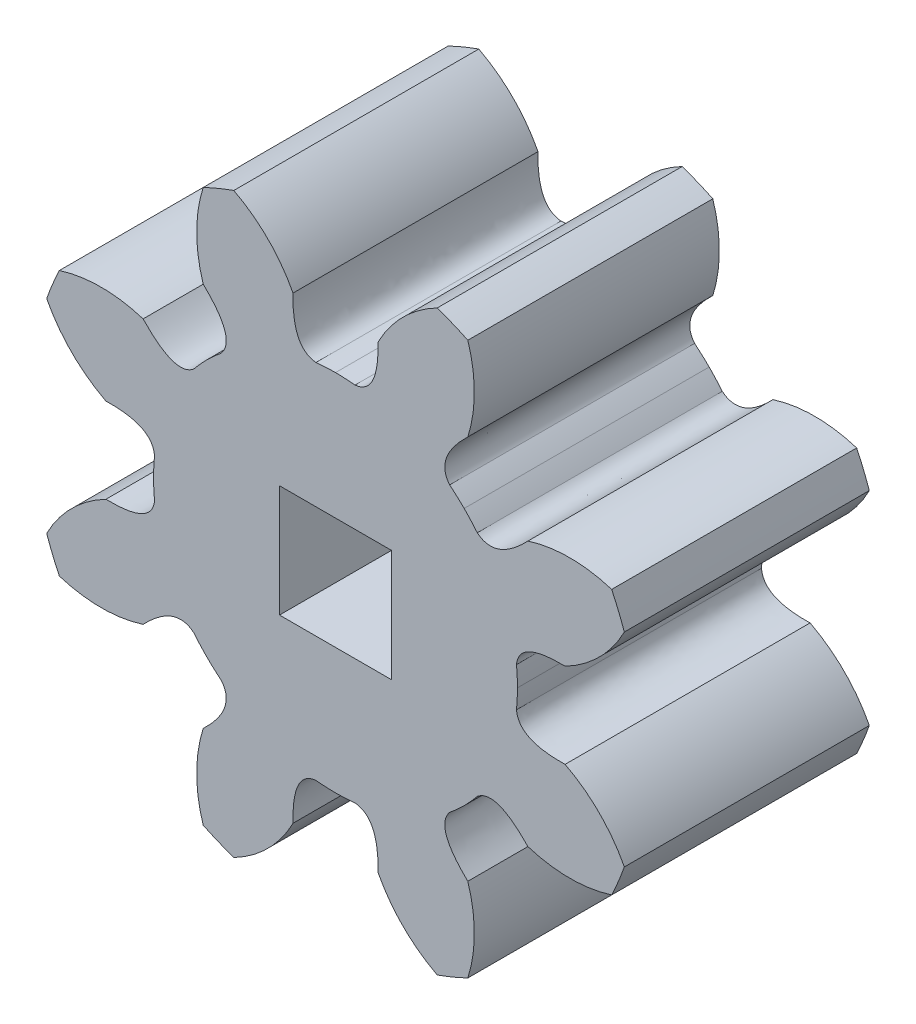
SolidWorks part; units mm, degrees
ref_plane "Front Plane" through (0, 0, 0) normal (0, 0, 1) x (1, 0, 0)
ref_plane "Top Plane" through (0, 0, 0) normal (0, 1, 0) x (1, 0, 0)
ref_plane "Right Plane" through (0, 0, 0) normal (1, 0, 0) x (0, 0, -1)
sketch "Sketch1" plane through (0, 0, 0) normal (0, 0, 1) x (1, 0, 0)
  line L0 (3.1669, -7.6908) -> (3.1183, -7.4689)
  line L1 (3.1183, -7.4689) -> (3.0812, -7.2576)
  line L2 (3.0812, -7.2576) -> (3.0547, -7.0583)
  line L3 (3.0547, -7.0583) -> (3.0374, -6.8671)
  line L4 (3.0374, -6.8671) -> (3.0287, -6.6862)
  line L5 (3.0287, -6.6862) -> (3.0277, -6.5196)
  line L6 (3.0277, -6.5196) -> (3.0333, -6.3633)
  line L7 (3.0333, -6.3633) -> (3.0445, -6.2188)
  line L8 (3.0445, -6.2188) -> (3.0799, -5.966)
  line L9 (3.0799, -5.966) -> (3.1262, -5.7615)
  line L10 (3.1262, -5.7615) -> (3.1751, -5.6067)
  line L11 (3.1751, -5.6067) -> (3.2199, -5.4976)
  line L12 (3.2199, -5.4976) -> (3.3298, -5.3972)
  line L13 (3.3298, -5.3972) -> (3.4539, -5.2724)
  line L14 (3.4539, -5.2724) -> (3.5614, -5.1472)
  line L15 (3.5614, -5.1472) -> (3.6523, -5.0227)
  line L16 (3.6523, -5.0227) -> (3.727, -4.9001)
  line L17 (3.727, -4.9001) -> (3.7859, -4.7804)
  line L18 (3.7859, -4.7804) -> (3.8292, -4.6649)
  line L19 (3.8292, -4.6649) -> (3.8574, -4.5546)
  line L20 (3.8574, -4.5546) -> (3.8712, -4.4505)
  line L21 (3.8712, -4.4505) -> (3.8711, -4.3537)
  line L22 (3.8711, -4.3537) -> (3.8576, -4.2651)
  line L23 (3.8576, -4.2651) -> (3.8317, -4.1856)
  line L24 (3.8317, -4.1856) -> (3.7939, -4.1161)
  line L25 (3.7939, -4.1161) -> (3.7383, -4.051)
  line L26 (3.7383, -4.051) -> (3.5929, -3.9283)
  line L27 (3.5929, -3.9283) -> (3.4307, -3.7816)
  line L28 (3.4307, -3.7816) -> (3.323, -3.677)
  line L29 (3.323, -3.677) -> (3.2184, -3.5693)
  line L30 (3.2184, -3.5693) -> (3.0717, -3.4071)
  line L31 (3.0717, -3.4071) -> (2.949, -3.2617)
  line L32 (2.949, -3.2617) -> (2.8839, -3.2061)
  line L33 (2.8839, -3.2061) -> (2.8144, -3.1683)
  line L34 (2.8144, -3.1683) -> (2.7349, -3.1424)
  line L35 (2.7349, -3.1424) -> (2.6463, -3.1289)
  line L36 (2.6463, -3.1289) -> (2.5495, -3.1288)
  line L37 (2.5495, -3.1288) -> (2.4454, -3.1426)
  line L38 (2.4454, -3.1426) -> (2.3351, -3.1708)
  line L39 (2.3351, -3.1708) -> (2.2196, -3.2141)
  line L40 (2.2196, -3.2141) -> (2.0999, -3.273)
  line L41 (2.0999, -3.273) -> (1.9773, -3.3477)
  line L42 (1.9773, -3.3477) -> (1.8528, -3.4386)
  line L43 (1.8528, -3.4386) -> (1.7276, -3.5461)
  line L44 (1.7276, -3.5461) -> (1.6028, -3.6702)
  line L45 (1.6028, -3.6702) -> (1.5024, -3.7801)
  line L46 (1.5024, -3.7801) -> (1.3933, -3.8249)
  line L47 (1.3933, -3.8249) -> (1.2385, -3.8738)
  line L48 (1.2385, -3.8738) -> (1.034, -3.9201)
  line L49 (1.034, -3.9201) -> (0.7812, -3.9555)
  line L50 (0.7812, -3.9555) -> (0.6367, -3.9667)
  line L51 (0.6367, -3.9667) -> (0.4804, -3.9723)
  line L52 (0.4804, -3.9723) -> (0.3138, -3.9713)
  line L53 (0.3138, -3.9713) -> (0.1329, -3.9626)
  line L54 (0.1329, -3.9626) -> (-0.0583, -3.9453)
  line L55 (-0.0583, -3.9453) -> (-0.2576, -3.9188)
  line L56 (-0.2576, -3.9188) -> (-0.4689, -3.8817)
  line L57 (-0.4689, -3.8817) -> (-0.6908, -3.8331)
  line L58 (-0.6908, -3.8331) -> (-0.891, -3.7806)
  line L59 (-1.2531, -2.9065) -> (-1.1486, -2.7278)
  line L60 (-1.1486, -2.7278) -> (-1.0261, -2.5365)
  line L61 (-1.0261, -2.5365) -> (-0.9029, -2.3609)
  line L62 (-0.9029, -2.3609) -> (-0.7807, -2.2012)
  line L63 (-0.7807, -2.2012) -> (-0.6577, -2.0538)
  line L64 (-0.6577, -2.0538) -> (-0.536, -1.9197)
  line L65 (-0.536, -1.9197) -> (-0.4189, -1.8013)
  line L66 (-0.4189, -1.8013) -> (-0.3044, -1.6946)
  line L67 (-0.3044, -1.6946) -> (-0.1943, -1.6004)
  line L68 (-0.1943, -1.6004) -> (0.0094, -1.4467)
  line L69 (0.0094, -1.4467) -> (0.1868, -1.3348)
  line L70 (0.1868, -1.3348) -> (0.3308, -1.2599)
  line L71 (0.3308, -1.2599) -> (0.4397, -1.2144)
  line L72 (0.4397, -1.2144) -> (0.5884, -1.2212)
  line L73 (0.5884, -1.2212) -> (0.7644, -1.2207)
  line L74 (0.7644, -1.2207) -> (0.9289, -1.2082)
  line L75 (0.9289, -1.2082) -> (1.0813, -1.1844)
  line L76 (1.0813, -1.1844) -> (1.2208, -1.1505)
  line L77 (1.2208, -1.1505) -> (1.347, -1.1075)
  line L78 (1.347, -1.1075) -> (1.4593, -1.0565)
  line L79 (1.4593, -1.0565) -> (1.5573, -0.9985)
  line L80 (1.5573, -0.9985) -> (1.6406, -0.9346)
  line L81 (1.6406, -0.9346) -> (1.709, -0.866)
  line L82 (1.709, -0.866) -> (1.7622, -0.7939)
  line L83 (1.7622, -0.7939) -> (1.8, -0.7193)
  line L84 (1.8, -0.7193) -> (1.8224, -0.6435)
  line L85 (1.8224, -0.6435) -> (1.8291, -0.5581)
  line L86 (1.8291, -0.5581) -> (1.8131, -0.3685)
  line L87 (1.8131, -0.3685) -> (1.8021, -0.1501)
  line L88 (1.8021, -0.1501) -> (1.8, 0)
  line L89 (1.8, 0) -> (1.8021, 0.1501)
  line L90 (1.8021, 0.1501) -> (1.8131, 0.3685)
  line L91 (1.8131, 0.3685) -> (1.8291, 0.5581)
  line L92 (1.8291, 0.5581) -> (1.8224, 0.6435)
  line L93 (1.8224, 0.6435) -> (1.8, 0.7193)
  line L94 (1.8, 0.7193) -> (1.7622, 0.7939)
  line L95 (1.7622, 0.7939) -> (1.709, 0.866)
  line L96 (1.709, 0.866) -> (1.6406, 0.9346)
  line L97 (1.6406, 0.9346) -> (1.5573, 0.9985)
  line L98 (1.5573, 0.9985) -> (1.4593, 1.0565)
  line L99 (1.4593, 1.0565) -> (1.347, 1.1075)
  line L100 (1.347, 1.1075) -> (1.2208, 1.1505)
  line L101 (1.2208, 1.1505) -> (1.0813, 1.1844)
  line L102 (1.0813, 1.1844) -> (0.9289, 1.2082)
  line L103 (0.9289, 1.2082) -> (0.7644, 1.2207)
  line L104 (0.7644, 1.2207) -> (0.5884, 1.2212)
  line L105 (0.5884, 1.2212) -> (0.4397, 1.2144)
  line L106 (0.4397, 1.2144) -> (0.3308, 1.2599)
  line L107 (0.3308, 1.2599) -> (0.1868, 1.3348)
  line L108 (0.1868, 1.3348) -> (0.0094, 1.4467)
  line L109 (0.0094, 1.4467) -> (-0.1943, 1.6004)
  line L110 (-0.1943, 1.6004) -> (-0.3044, 1.6946)
  line L111 (-0.3044, 1.6946) -> (-0.4189, 1.8013)
  line L112 (-0.4189, 1.8013) -> (-0.536, 1.9197)
  line L113 (-0.536, 1.9197) -> (-0.6577, 2.0538)
  line L114 (-0.6577, 2.0538) -> (-0.7807, 2.2012)
  line L115 (-0.7807, 2.2012) -> (-0.9029, 2.3609)
  line L116 (-0.9029, 2.3609) -> (-1.0261, 2.5365)
  line L117 (-1.0261, 2.5365) -> (-1.1486, 2.7278)
  line L118 (-1.1486, 2.7278) -> (-1.2531, 2.9065)
  line L119 (-0.891, 3.7806) -> (-0.6908, 3.8331)
  line L120 (-0.6908, 3.8331) -> (-0.4689, 3.8817)
  line L121 (-0.4689, 3.8817) -> (-0.2576, 3.9188)
  line L122 (-0.2576, 3.9188) -> (-0.0583, 3.9453)
  line L123 (-0.0583, 3.9453) -> (0.1329, 3.9626)
  line L124 (0.1329, 3.9626) -> (0.3138, 3.9713)
  line L125 (0.3138, 3.9713) -> (0.4804, 3.9723)
  line L126 (0.4804, 3.9723) -> (0.6367, 3.9667)
  line L127 (0.6367, 3.9667) -> (0.7812, 3.9555)
  line L128 (0.7812, 3.9555) -> (1.034, 3.9201)
  line L129 (1.034, 3.9201) -> (1.2385, 3.8738)
  line L130 (1.2385, 3.8738) -> (1.3933, 3.8249)
  line L131 (1.3933, 3.8249) -> (1.5024, 3.7801)
  line L132 (1.5024, 3.7801) -> (1.6028, 3.6702)
  line L133 (1.6028, 3.6702) -> (1.7276, 3.5461)
  line L134 (1.7276, 3.5461) -> (1.8528, 3.4386)
  line L135 (1.8528, 3.4386) -> (1.9773, 3.3477)
  line L136 (1.9773, 3.3477) -> (2.0999, 3.273)
  line L137 (2.0999, 3.273) -> (2.2196, 3.2141)
  line L138 (2.2196, 3.2141) -> (2.3351, 3.1708)
  line L139 (2.3351, 3.1708) -> (2.4454, 3.1426)
  line L140 (2.4454, 3.1426) -> (2.5495, 3.1288)
  line L141 (2.5495, 3.1288) -> (2.6463, 3.1289)
  line L142 (2.6463, 3.1289) -> (2.7349, 3.1424)
  line L143 (2.7349, 3.1424) -> (2.8144, 3.1683)
  line L144 (2.8144, 3.1683) -> (2.8839, 3.2061)
  line L145 (2.8839, 3.2061) -> (2.949, 3.2617)
  line L146 (2.949, 3.2617) -> (3.0717, 3.4071)
  line L147 (3.0717, 3.4071) -> (3.2184, 3.5693)
  line L148 (3.2184, 3.5693) -> (3.323, 3.677)
  line L149 (3.323, 3.677) -> (3.4307, 3.7816)
  line L150 (3.4307, 3.7816) -> (3.5929, 3.9283)
  line L151 (3.5929, 3.9283) -> (3.7383, 4.051)
  line L152 (3.7383, 4.051) -> (3.7939, 4.1161)
  line L153 (3.7939, 4.1161) -> (3.8317, 4.1856)
  line L154 (3.8317, 4.1856) -> (3.8576, 4.2651)
  line L155 (3.8576, 4.2651) -> (3.8711, 4.3537)
  line L156 (3.8711, 4.3537) -> (3.8712, 4.4505)
  line L157 (3.8712, 4.4505) -> (3.8574, 4.5546)
  line L158 (3.8574, 4.5546) -> (3.8292, 4.6649)
  line L159 (3.8292, 4.6649) -> (3.7859, 4.7804)
  line L160 (3.7859, 4.7804) -> (3.727, 4.9001)
  line L161 (3.727, 4.9001) -> (3.6523, 5.0227)
  line L162 (3.6523, 5.0227) -> (3.5614, 5.1472)
  line L163 (3.5614, 5.1472) -> (3.4539, 5.2724)
  line L164 (3.4539, 5.2724) -> (3.3298, 5.3972)
  line L165 (3.3298, 5.3972) -> (3.2199, 5.4976)
  line L166 (3.2199, 5.4976) -> (3.1751, 5.6067)
  line L167 (3.1751, 5.6067) -> (3.1262, 5.7615)
  line L168 (3.1262, 5.7615) -> (3.0799, 5.966)
  line L169 (3.0799, 5.966) -> (3.0445, 6.2188)
  line L170 (3.0445, 6.2188) -> (3.0333, 6.3633)
  line L171 (3.0333, 6.3633) -> (3.0277, 6.5196)
  line L172 (3.0277, 6.5196) -> (3.0287, 6.6862)
  line L173 (3.0287, 6.6862) -> (3.0374, 6.8671)
  line L174 (3.0374, 6.8671) -> (3.0547, 7.0583)
  line L175 (3.0547, 7.0583) -> (3.0812, 7.2576)
  line L176 (3.0812, 7.2576) -> (3.1183, 7.4689)
  line L177 (3.1183, 7.4689) -> (3.1669, 7.6908)
  line L178 (3.1669, 7.6908) -> (3.2194, 7.891)
  line L179 (4.0935, 8.2531) -> (4.2722, 8.1486)
  line L180 (4.2722, 8.1486) -> (4.4635, 8.0261)
  line L181 (4.4635, 8.0261) -> (4.6391, 7.9029)
  line L182 (4.6391, 7.9029) -> (4.7988, 7.7807)
  line L183 (4.7988, 7.7807) -> (4.9462, 7.6577)
  line L184 (4.9462, 7.6577) -> (5.0803, 7.536)
  line L185 (5.0803, 7.536) -> (5.1988, 7.4189)
  line L186 (5.1988, 7.4189) -> (5.3054, 7.3044)
  line L187 (5.3054, 7.3044) -> (5.3996, 7.1943)
  line L188 (5.3996, 7.1943) -> (5.5533, 6.9906)
  line L189 (5.5533, 6.9906) -> (5.6652, 6.8132)
  line L190 (5.6652, 6.8132) -> (5.7401, 6.6692)
  line L191 (5.7401, 6.6692) -> (5.7856, 6.5603)
  line L192 (5.7856, 6.5603) -> (5.7788, 6.4116)
  line L193 (5.7788, 6.4116) -> (5.7793, 6.2356)
  line L194 (5.7793, 6.2356) -> (5.7918, 6.0711)
  line L195 (5.7918, 6.0711) -> (5.8156, 5.9187)
  line L196 (5.8156, 5.9187) -> (5.8495, 5.7792)
  line L197 (5.8495, 5.7792) -> (5.8925, 5.653)
  line L198 (5.8925, 5.653) -> (5.9435, 5.5407)
  line L199 (5.9435, 5.5407) -> (6.0015, 5.4427)
  line L200 (6.0015, 5.4427) -> (6.0654, 5.3594)
  line L201 (6.0654, 5.3594) -> (6.134, 5.291)
  line L202 (6.134, 5.291) -> (6.2061, 5.2378)
  line L203 (6.2061, 5.2378) -> (6.2807, 5.2)
  line L204 (6.2807, 5.2) -> (6.3565, 5.1776)
  line L205 (6.3565, 5.1776) -> (6.4419, 5.1709)
  line L206 (6.4419, 5.1709) -> (6.6315, 5.1869)
  line L207 (6.6315, 5.1869) -> (6.8499, 5.1979)
  line L208 (6.8499, 5.1979) -> (7, 5.2)
  line L209 (7, 5.2) -> (7.1501, 5.1979)
  line L210 (7.1501, 5.1979) -> (7.3685, 5.1869)
  line L211 (7.3685, 5.1869) -> (7.5581, 5.1709)
  line L212 (7.5581, 5.1709) -> (7.6435, 5.1776)
  line L213 (7.6435, 5.1776) -> (7.7193, 5.2)
  line L214 (7.7193, 5.2) -> (7.7939, 5.2378)
  line L215 (7.7939, 5.2378) -> (7.866, 5.291)
  line L216 (7.866, 5.291) -> (7.9346, 5.3594)
  line L217 (7.9346, 5.3594) -> (7.9985, 5.4427)
  line L218 (7.9985, 5.4427) -> (8.0565, 5.5407)
  line L219 (8.0565, 5.5407) -> (8.1075, 5.653)
  line L220 (8.1075, 5.653) -> (8.1505, 5.7792)
  line L221 (8.1505, 5.7792) -> (8.1844, 5.9187)
  line L222 (8.1844, 5.9187) -> (8.2082, 6.0711)
  line L223 (8.2082, 6.0711) -> (8.2207, 6.2356)
  line L224 (8.2207, 6.2356) -> (8.2212, 6.4116)
  line L225 (8.2212, 6.4116) -> (8.2144, 6.5603)
  line L226 (8.2144, 6.5603) -> (8.2599, 6.6692)
  line L227 (8.2599, 6.6692) -> (8.3348, 6.8132)
  line L228 (8.3348, 6.8132) -> (8.4467, 6.9906)
  line L229 (8.4467, 6.9906) -> (8.6004, 7.1943)
  line L230 (8.6004, 7.1943) -> (8.6946, 7.3044)
  line L231 (8.6946, 7.3044) -> (8.8012, 7.4189)
  line L232 (8.8012, 7.4189) -> (8.9197, 7.536)
  line L233 (8.9197, 7.536) -> (9.0538, 7.6577)
  line L234 (9.0538, 7.6577) -> (9.2012, 7.7807)
  line L235 (9.2012, 7.7807) -> (9.3609, 7.9029)
  line L236 (9.3609, 7.9029) -> (9.5365, 8.0261)
  line L237 (9.5365, 8.0261) -> (9.7278, 8.1486)
  line L238 (9.7278, 8.1486) -> (9.9065, 8.2531)
  line L239 (10.7806, 7.891) -> (10.8331, 7.6908)
  line L240 (10.8331, 7.6908) -> (10.8817, 7.4689)
  line L241 (10.8817, 7.4689) -> (10.9188, 7.2576)
  line L242 (10.9188, 7.2576) -> (10.9453, 7.0583)
  line L243 (10.9453, 7.0583) -> (10.9626, 6.8671)
  line L244 (10.9626, 6.8671) -> (10.9713, 6.6862)
  line L245 (10.9713, 6.6862) -> (10.9723, 6.5196)
  line L246 (10.9723, 6.5196) -> (10.9667, 6.3633)
  line L247 (10.9667, 6.3633) -> (10.9555, 6.2188)
  line L248 (10.9555, 6.2188) -> (10.9201, 5.966)
  line L249 (10.9201, 5.966) -> (10.8738, 5.7615)
  line L250 (10.8738, 5.7615) -> (10.8249, 5.6067)
  line L251 (10.8249, 5.6067) -> (10.7801, 5.4976)
  line L252 (10.7801, 5.4976) -> (10.6702, 5.3972)
  line L253 (10.6702, 5.3972) -> (10.5461, 5.2724)
  line L254 (10.5461, 5.2724) -> (10.4386, 5.1472)
  line L255 (10.4386, 5.1472) -> (10.3477, 5.0227)
  line L256 (10.3477, 5.0227) -> (10.273, 4.9001)
  line L257 (10.273, 4.9001) -> (10.2141, 4.7804)
  line L258 (10.2141, 4.7804) -> (10.1708, 4.6649)
  line L259 (10.1708, 4.6649) -> (10.1426, 4.5546)
  line L260 (10.1426, 4.5546) -> (10.1288, 4.4505)
  line L261 (10.1288, 4.4505) -> (10.1289, 4.3537)
  line L262 (10.1289, 4.3537) -> (10.1424, 4.2651)
  line L263 (10.1424, 4.2651) -> (10.1683, 4.1856)
  line L264 (10.1683, 4.1856) -> (10.2061, 4.1161)
  line L265 (10.2061, 4.1161) -> (10.2617, 4.051)
  line L266 (10.2617, 4.051) -> (10.4071, 3.9283)
  line L267 (10.4071, 3.9283) -> (10.5693, 3.7816)
  line L268 (10.5693, 3.7816) -> (10.677, 3.677)
  line L269 (10.677, 3.677) -> (10.7816, 3.5693)
  line L270 (10.7816, 3.5693) -> (10.9283, 3.4071)
  line L271 (10.9283, 3.4071) -> (11.051, 3.2617)
  line L272 (11.051, 3.2617) -> (11.1161, 3.2061)
  line L273 (11.1161, 3.2061) -> (11.1856, 3.1683)
  line L274 (11.1856, 3.1683) -> (11.2651, 3.1424)
  line L275 (11.2651, 3.1424) -> (11.3537, 3.1289)
  line L276 (11.3537, 3.1289) -> (11.4505, 3.1288)
  line L277 (11.4505, 3.1288) -> (11.5546, 3.1426)
  line L278 (11.5546, 3.1426) -> (11.6649, 3.1708)
  line L279 (11.6649, 3.1708) -> (11.7804, 3.2141)
  line L280 (11.7804, 3.2141) -> (11.9001, 3.273)
  line L281 (11.9001, 3.273) -> (12.0227, 3.3477)
  line L282 (12.0227, 3.3477) -> (12.1472, 3.4386)
  line L283 (12.1472, 3.4386) -> (12.2724, 3.5461)
  line L284 (12.2724, 3.5461) -> (12.3972, 3.6702)
  line L285 (12.3972, 3.6702) -> (12.4976, 3.7801)
  line L286 (12.4976, 3.7801) -> (12.6067, 3.8249)
  line L287 (12.6067, 3.8249) -> (12.7615, 3.8738)
  line L288 (12.7615, 3.8738) -> (12.966, 3.9201)
  line L289 (12.966, 3.9201) -> (13.2188, 3.9555)
  line L290 (13.2188, 3.9555) -> (13.3633, 3.9667)
  line L291 (13.3633, 3.9667) -> (13.5196, 3.9723)
  line L292 (13.5196, 3.9723) -> (13.6862, 3.9713)
  line L293 (13.6862, 3.9713) -> (13.8671, 3.9626)
  line L294 (13.8671, 3.9626) -> (14.0583, 3.9453)
  line L295 (14.0583, 3.9453) -> (14.2576, 3.9188)
  line L296 (14.2576, 3.9188) -> (14.4689, 3.8817)
  line L297 (14.4689, 3.8817) -> (14.6908, 3.8331)
  line L298 (14.6908, 3.8331) -> (14.891, 3.7806)
  line L299 (15.2531, 2.9065) -> (15.1486, 2.7278)
  line L300 (15.1486, 2.7278) -> (15.0261, 2.5365)
  line L301 (15.0261, 2.5365) -> (14.9029, 2.3609)
  line L302 (14.9029, 2.3609) -> (14.7807, 2.2012)
  line L303 (14.7807, 2.2012) -> (14.6577, 2.0538)
  line L304 (14.6577, 2.0538) -> (14.536, 1.9197)
  line L305 (14.536, 1.9197) -> (14.4189, 1.8013)
  line L306 (14.4189, 1.8013) -> (14.3044, 1.6946)
  line L307 (14.3044, 1.6946) -> (14.1943, 1.6004)
  line L308 (14.1943, 1.6004) -> (13.9906, 1.4467)
  line L309 (13.9906, 1.4467) -> (13.8132, 1.3348)
  line L310 (13.8132, 1.3348) -> (13.6692, 1.2599)
  line L311 (13.6692, 1.2599) -> (13.5603, 1.2144)
  line L312 (13.5603, 1.2144) -> (13.4116, 1.2212)
  line L313 (13.4116, 1.2212) -> (13.2356, 1.2207)
  line L314 (13.2356, 1.2207) -> (13.0711, 1.2082)
  line L315 (13.0711, 1.2082) -> (12.9187, 1.1844)
  line L316 (12.9187, 1.1844) -> (12.7792, 1.1505)
  line L317 (12.7792, 1.1505) -> (12.653, 1.1075)
  line L318 (12.653, 1.1075) -> (12.5407, 1.0565)
  line L319 (12.5407, 1.0565) -> (12.4427, 0.9985)
  line L320 (12.4427, 0.9985) -> (12.3594, 0.9346)
  line L321 (12.3594, 0.9346) -> (12.291, 0.866)
  line L322 (12.291, 0.866) -> (12.2378, 0.7939)
  line L323 (12.2378, 0.7939) -> (12.2, 0.7193)
  line L324 (12.2, 0.7193) -> (12.1776, 0.6435)
  line L325 (12.1776, 0.6435) -> (12.1709, 0.5581)
  line L326 (12.1709, 0.5581) -> (12.1869, 0.3685)
  line L327 (12.1869, 0.3685) -> (12.1979, 0.1501)
  line L328 (12.1979, 0.1501) -> (12.2, 0)
  line L329 (12.2, 0) -> (12.1979, -0.1501)
  line L330 (12.1979, -0.1501) -> (12.1869, -0.3685)
  line L331 (12.1869, -0.3685) -> (12.1709, -0.5581)
  line L332 (12.1709, -0.5581) -> (12.1776, -0.6435)
  line L333 (12.1776, -0.6435) -> (12.2, -0.7193)
  line L334 (12.2, -0.7193) -> (12.2378, -0.7939)
  line L335 (12.2378, -0.7939) -> (12.291, -0.866)
  line L336 (12.291, -0.866) -> (12.3594, -0.9346)
  line L337 (12.3594, -0.9346) -> (12.4427, -0.9985)
  line L338 (12.4427, -0.9985) -> (12.5407, -1.0565)
  line L339 (12.5407, -1.0565) -> (12.653, -1.1075)
  line L340 (12.653, -1.1075) -> (12.7792, -1.1505)
  line L341 (12.7792, -1.1505) -> (12.9187, -1.1844)
  line L342 (12.9187, -1.1844) -> (13.0711, -1.2082)
  line L343 (13.0711, -1.2082) -> (13.2356, -1.2207)
  line L344 (13.2356, -1.2207) -> (13.4116, -1.2212)
  line L345 (13.4116, -1.2212) -> (13.5603, -1.2144)
  line L346 (13.5603, -1.2144) -> (13.6692, -1.2599)
  line L347 (13.6692, -1.2599) -> (13.8132, -1.3348)
  line L348 (13.8132, -1.3348) -> (13.9906, -1.4467)
  line L349 (13.9906, -1.4467) -> (14.1943, -1.6004)
  line L350 (14.1943, -1.6004) -> (14.3044, -1.6946)
  line L351 (14.3044, -1.6946) -> (14.4189, -1.8013)
  line L352 (14.4189, -1.8013) -> (14.536, -1.9197)
  line L353 (14.536, -1.9197) -> (14.6577, -2.0538)
  line L354 (14.6577, -2.0538) -> (14.7807, -2.2012)
  line L355 (14.7807, -2.2012) -> (14.9029, -2.3609)
  line L356 (14.9029, -2.3609) -> (15.0261, -2.5365)
  line L357 (15.0261, -2.5365) -> (15.1486, -2.7278)
  line L358 (15.1486, -2.7278) -> (15.2531, -2.9065)
  line L359 (14.891, -3.7806) -> (14.6908, -3.8331)
  line L360 (14.6908, -3.8331) -> (14.4689, -3.8817)
  line L361 (14.4689, -3.8817) -> (14.2576, -3.9188)
  line L362 (14.2576, -3.9188) -> (14.0583, -3.9453)
  line L363 (14.0583, -3.9453) -> (13.8671, -3.9626)
  line L364 (13.8671, -3.9626) -> (13.6862, -3.9713)
  line L365 (13.6862, -3.9713) -> (13.5196, -3.9723)
  line L366 (13.5196, -3.9723) -> (13.3633, -3.9667)
  line L367 (13.3633, -3.9667) -> (13.2188, -3.9555)
  line L368 (13.2188, -3.9555) -> (12.966, -3.9201)
  line L369 (12.966, -3.9201) -> (12.7615, -3.8738)
  line L370 (12.7615, -3.8738) -> (12.6067, -3.8249)
  line L371 (12.6067, -3.8249) -> (12.4976, -3.7801)
  line L372 (12.4976, -3.7801) -> (12.3972, -3.6702)
  line L373 (12.3972, -3.6702) -> (12.2724, -3.5461)
  line L374 (12.2724, -3.5461) -> (12.1472, -3.4386)
  line L375 (12.1472, -3.4386) -> (12.0227, -3.3477)
  line L376 (12.0227, -3.3477) -> (11.9001, -3.273)
  line L377 (11.9001, -3.273) -> (11.7804, -3.2141)
  line L378 (11.7804, -3.2141) -> (11.6649, -3.1708)
  line L379 (11.6649, -3.1708) -> (11.5546, -3.1426)
  line L380 (11.5546, -3.1426) -> (11.4505, -3.1288)
  line L381 (11.4505, -3.1288) -> (11.3537, -3.1289)
  line L382 (11.3537, -3.1289) -> (11.2651, -3.1424)
  line L383 (11.2651, -3.1424) -> (11.1856, -3.1683)
  line L384 (11.1856, -3.1683) -> (11.1161, -3.2061)
  line L385 (11.1161, -3.2061) -> (11.051, -3.2617)
  line L386 (11.051, -3.2617) -> (10.9283, -3.4071)
  line L387 (10.9283, -3.4071) -> (10.7816, -3.5693)
  line L388 (10.7816, -3.5693) -> (10.677, -3.677)
  line L389 (10.677, -3.677) -> (10.5693, -3.7816)
  line L390 (10.5693, -3.7816) -> (10.4071, -3.9283)
  line L391 (10.4071, -3.9283) -> (10.2617, -4.051)
  line L392 (10.2617, -4.051) -> (10.2061, -4.1161)
  line L393 (10.2061, -4.1161) -> (10.1683, -4.1856)
  line L394 (10.1683, -4.1856) -> (10.1424, -4.2651)
  line L395 (10.1424, -4.2651) -> (10.1289, -4.3537)
  line L396 (10.1289, -4.3537) -> (10.1288, -4.4505)
  line L397 (10.1288, -4.4505) -> (10.1426, -4.5546)
  line L398 (10.1426, -4.5546) -> (10.1708, -4.6649)
  line L399 (10.1708, -4.6649) -> (10.2141, -4.7804)
  line L400 (10.2141, -4.7804) -> (10.273, -4.9001)
  line L401 (10.273, -4.9001) -> (10.3477, -5.0227)
  line L402 (10.3477, -5.0227) -> (10.4386, -5.1472)
  line L403 (10.4386, -5.1472) -> (10.5461, -5.2724)
  line L404 (10.5461, -5.2724) -> (10.6702, -5.3972)
  line L405 (10.6702, -5.3972) -> (10.7801, -5.4976)
  line L406 (10.7801, -5.4976) -> (10.8249, -5.6067)
  line L407 (10.8249, -5.6067) -> (10.8738, -5.7615)
  line L408 (10.8738, -5.7615) -> (10.9201, -5.966)
  line L409 (10.9201, -5.966) -> (10.9555, -6.2188)
  line L410 (10.9555, -6.2188) -> (10.9667, -6.3633)
  line L411 (10.9667, -6.3633) -> (10.9723, -6.5196)
  line L412 (10.9723, -6.5196) -> (10.9713, -6.6862)
  line L413 (10.9713, -6.6862) -> (10.9626, -6.8671)
  line L414 (10.9626, -6.8671) -> (10.9453, -7.0583)
  line L415 (10.9453, -7.0583) -> (10.9188, -7.2576)
  line L416 (10.9188, -7.2576) -> (10.8817, -7.4689)
  line L417 (10.8817, -7.4689) -> (10.8331, -7.6908)
  line L418 (10.8331, -7.6908) -> (10.7806, -7.891)
  line L419 (9.9065, -8.2531) -> (9.7278, -8.1486)
  line L420 (9.7278, -8.1486) -> (9.5365, -8.0261)
  line L421 (9.5365, -8.0261) -> (9.3609, -7.9029)
  line L422 (9.3609, -7.9029) -> (9.2012, -7.7807)
  line L423 (9.2012, -7.7807) -> (9.0538, -7.6577)
  line L424 (9.0538, -7.6577) -> (8.9197, -7.536)
  line L425 (8.9197, -7.536) -> (8.8012, -7.4189)
  line L426 (8.8012, -7.4189) -> (8.6946, -7.3044)
  line L427 (8.6946, -7.3044) -> (8.6004, -7.1943)
  line L428 (8.6004, -7.1943) -> (8.4467, -6.9906)
  line L429 (8.4467, -6.9906) -> (8.3348, -6.8132)
  line L430 (8.3348, -6.8132) -> (8.2599, -6.6692)
  line L431 (8.2599, -6.6692) -> (8.2144, -6.5603)
  line L432 (8.2144, -6.5603) -> (8.2212, -6.4116)
  line L433 (8.2212, -6.4116) -> (8.2207, -6.2356)
  line L434 (8.2207, -6.2356) -> (8.2082, -6.0711)
  line L435 (8.2082, -6.0711) -> (8.1844, -5.9187)
  line L436 (8.1844, -5.9187) -> (8.1505, -5.7792)
  line L437 (8.1505, -5.7792) -> (8.1075, -5.653)
  line L438 (8.1075, -5.653) -> (8.0565, -5.5407)
  line L439 (8.0565, -5.5407) -> (7.9985, -5.4427)
  line L440 (7.9985, -5.4427) -> (7.9346, -5.3594)
  line L441 (7.9346, -5.3594) -> (7.866, -5.291)
  line L442 (7.866, -5.291) -> (7.7939, -5.2378)
  line L443 (7.7939, -5.2378) -> (7.7193, -5.2)
  line L444 (7.7193, -5.2) -> (7.6435, -5.1776)
  line L445 (7.6435, -5.1776) -> (7.5581, -5.1709)
  line L446 (7.5581, -5.1709) -> (7.3685, -5.1869)
  line L447 (7.3685, -5.1869) -> (7.1501, -5.1979)
  line L448 (7.1501, -5.1979) -> (7, -5.2)
  line L449 (7, -5.2) -> (6.8499, -5.1979)
  line L450 (6.8499, -5.1979) -> (6.6315, -5.1869)
  line L451 (6.6315, -5.1869) -> (6.4419, -5.1709)
  line L452 (6.4419, -5.1709) -> (6.3565, -5.1776)
  line L453 (6.3565, -5.1776) -> (6.2807, -5.2)
  line L454 (6.2807, -5.2) -> (6.2061, -5.2378)
  line L455 (6.2061, -5.2378) -> (6.134, -5.291)
  line L456 (6.134, -5.291) -> (6.0654, -5.3594)
  line L457 (6.0654, -5.3594) -> (6.0015, -5.4427)
  line L458 (6.0015, -5.4427) -> (5.9435, -5.5407)
  line L459 (5.9435, -5.5407) -> (5.8925, -5.653)
  line L460 (5.8925, -5.653) -> (5.8495, -5.7792)
  line L461 (5.8495, -5.7792) -> (5.8156, -5.9187)
  line L462 (5.8156, -5.9187) -> (5.7918, -6.0711)
  line L463 (5.7918, -6.0711) -> (5.7793, -6.2356)
  line L464 (5.7793, -6.2356) -> (5.7788, -6.4116)
  line L465 (5.7788, -6.4116) -> (5.7856, -6.5603)
  line L466 (5.7856, -6.5603) -> (5.7401, -6.6692)
  line L467 (5.7401, -6.6692) -> (5.6652, -6.8132)
  line L468 (5.6652, -6.8132) -> (5.5533, -6.9906)
  line L469 (5.5533, -6.9906) -> (5.3996, -7.1943)
  line L470 (5.3996, -7.1943) -> (5.3054, -7.3044)
  line L471 (5.3054, -7.3044) -> (5.1988, -7.4189)
  line L472 (5.1988, -7.4189) -> (5.0803, -7.536)
  line L473 (5.0803, -7.536) -> (4.9462, -7.6577)
  line L474 (4.9462, -7.6577) -> (4.7988, -7.7807)
  line L475 (4.7988, -7.7807) -> (4.6391, -7.9029)
  line L476 (4.6391, -7.9029) -> (4.4635, -8.0261)
  line L477 (4.4635, -8.0261) -> (4.2722, -8.1486)
  line L478 (4.2722, -8.1486) -> (4.0935, -8.2531)
  line L479 (3.2194, -7.891) -> (3.1669, -7.6908)
  line L480 (3.1669, -7.6908) -> (3.1183, -7.4689)
  line L481 (3.1183, -7.4689) -> (3.0812, -7.2576)
  line L482 (3.0812, -7.2576) -> (3.0547, -7.0583)
  line L483 (3.0547, -7.0583) -> (3.0374, -6.8671)
  line L484 (3.0374, -6.8671) -> (3.0287, -6.6862)
  line L485 (3.0287, -6.6862) -> (3.0277, -6.5196)
  line L486 (3.0277, -6.5196) -> (3.0333, -6.3633)
  line L487 (3.0333, -6.3633) -> (3.0445, -6.2188)
  line L488 (3.0445, -6.2188) -> (3.0799, -5.966)
  line L489 (3.0799, -5.966) -> (3.1262, -5.7615)
  line L490 (3.1262, -5.7615) -> (3.1751, -5.6067)
  line L491 (3.1751, -5.6067) -> (3.2199, -5.4976)
  line L492 (3.2199, -5.4976) -> (3.3298, -5.3972)
  line L493 (3.3298, -5.3972) -> (3.4539, -5.2724)
  line L494 (3.4539, -5.2724) -> (3.5614, -5.1472)
  line L495 (3.5614, -5.1472) -> (3.6523, -5.0227)
  line L496 (3.6523, -5.0227) -> (3.727, -4.9001)
  line L497 (3.727, -4.9001) -> (3.7859, -4.7804)
  line L498 (3.7859, -4.7804) -> (3.8292, -4.6649)
  line L499 (3.8292, -4.6649) -> (3.8574, -4.5546)
  line L500 (3.8574, -4.5546) -> (3.8712, -4.4505)
  line L501 (3.8712, -4.4505) -> (3.8711, -4.3537)
  line L502 (3.8711, -4.3537) -> (3.8576, -4.2651)
  line L503 (3.8576, -4.2651) -> (3.8317, -4.1856)
  line L504 (3.8317, -4.1856) -> (3.7939, -4.1161)
  line L505 (3.7939, -4.1161) -> (3.7383, -4.051)
  line L506 (3.7383, -4.051) -> (3.5929, -3.9283)
  line L507 (3.5929, -3.9283) -> (3.4307, -3.7816)
  line L508 (3.4307, -3.7816) -> (3.323, -3.677)
  line L509 (3.323, -3.677) -> (3.2184, -3.5693)
  line L510 (3.2184, -3.5693) -> (3.0717, -3.4071)
  line L511 (3.0717, -3.4071) -> (2.949, -3.2617)
  line L512 (2.949, -3.2617) -> (2.8839, -3.2061)
  line L513 (2.8839, -3.2061) -> (2.8144, -3.1683)
  line L514 (2.8144, -3.1683) -> (2.7349, -3.1424)
  line L515 (2.7349, -3.1424) -> (2.6463, -3.1289)
  line L516 (2.6463, -3.1289) -> (2.5495, -3.1288)
  line L517 (2.5495, -3.1288) -> (2.4454, -3.1426)
  line L518 (2.4454, -3.1426) -> (2.3351, -3.1708)
  line L519 (2.3351, -3.1708) -> (2.2196, -3.2141)
  line L520 (2.2196, -3.2141) -> (2.0999, -3.273)
  line L521 (2.0999, -3.273) -> (1.9773, -3.3477)
  line L522 (1.9773, -3.3477) -> (1.8528, -3.4386)
  line L523 (1.8528, -3.4386) -> (1.7276, -3.5461)
  line L524 (1.7276, -3.5461) -> (1.6028, -3.6702)
  line L525 (1.6028, -3.6702) -> (1.5024, -3.7801)
  line L526 (1.5024, -3.7801) -> (1.3933, -3.8249)
  line L527 (1.3933, -3.8249) -> (1.2385, -3.8738)
  line L528 (1.2385, -3.8738) -> (1.034, -3.9201)
  line L529 (1.034, -3.9201) -> (0.7812, -3.9555)
  line L530 (0.7812, -3.9555) -> (0.6367, -3.9667)
  line L531 (0.6367, -3.9667) -> (0.4804, -3.9723)
  line L532 (0.4804, -3.9723) -> (0.3138, -3.9713)
  line L533 (0.3138, -3.9713) -> (0.1329, -3.9626)
  line L534 (0.1329, -3.9626) -> (-0.0583, -3.9453)
  line L535 (-0.0583, -3.9453) -> (-0.2576, -3.9188)
  line L536 (-0.2576, -3.9188) -> (-0.4689, -3.8817)
  line L537 (-0.4689, -3.8817) -> (-0.6908, -3.8331)
  line L538 (-0.6908, -3.8331) -> (-0.891, -3.7806)
  line L539 (-1.2531, -2.9065) -> (-1.1486, -2.7278)
  line L540 (-1.1486, -2.7278) -> (-1.0261, -2.5365)
  line L541 (-1.0261, -2.5365) -> (-0.9029, -2.3609)
  line L542 (-0.9029, -2.3609) -> (-0.7807, -2.2012)
  line L543 (-0.7807, -2.2012) -> (-0.6577, -2.0538)
  line L544 (-0.6577, -2.0538) -> (-0.536, -1.9197)
  line L545 (-0.536, -1.9197) -> (-0.4189, -1.8013)
  line L546 (-0.4189, -1.8013) -> (-0.3044, -1.6946)
  line L547 (-0.3044, -1.6946) -> (-0.1943, -1.6004)
  line L548 (-0.1943, -1.6004) -> (0.0094, -1.4467)
  line L549 (0.0094, -1.4467) -> (0.1868, -1.3348)
  line L550 (0.1868, -1.3348) -> (0.3308, -1.2599)
  line L551 (0.3308, -1.2599) -> (0.4397, -1.2144)
  line L552 (0.4397, -1.2144) -> (0.5884, -1.2212)
  line L553 (0.5884, -1.2212) -> (0.7644, -1.2207)
  line L554 (0.7644, -1.2207) -> (0.9289, -1.2082)
  line L555 (0.9289, -1.2082) -> (1.0813, -1.1844)
  line L556 (1.0813, -1.1844) -> (1.2208, -1.1505)
  line L557 (1.2208, -1.1505) -> (1.347, -1.1075)
  line L558 (1.347, -1.1075) -> (1.4593, -1.0565)
  line L559 (1.4593, -1.0565) -> (1.5573, -0.9985)
  line L560 (1.5573, -0.9985) -> (1.6406, -0.9346)
  line L561 (1.6406, -0.9346) -> (1.709, -0.866)
  line L562 (1.709, -0.866) -> (1.7622, -0.7939)
  line L563 (1.7622, -0.7939) -> (1.8, -0.7193)
  line L564 (1.8, -0.7193) -> (1.8224, -0.6435)
  line L565 (1.8224, -0.6435) -> (1.8291, -0.5581)
  line L566 (1.8291, -0.5581) -> (1.8131, -0.3685)
  line L567 (1.8131, -0.3685) -> (1.8021, -0.1501)
  line L568 (1.8021, -0.1501) -> (1.8, 0)
  line L569 (1.8, 0) -> (1.8021, 0.1501)
  line L570 (1.8021, 0.1501) -> (1.8131, 0.3685)
  line L571 (1.8131, 0.3685) -> (1.8291, 0.5581)
  line L572 (1.8291, 0.5581) -> (1.8224, 0.6435)
  line L573 (1.8224, 0.6435) -> (1.8, 0.7193)
  line L574 (1.8, 0.7193) -> (1.7622, 0.7939)
  line L575 (1.7622, 0.7939) -> (1.709, 0.866)
  line L576 (1.709, 0.866) -> (1.6406, 0.9346)
  line L577 (1.6406, 0.9346) -> (1.5573, 0.9985)
  line L578 (1.5573, 0.9985) -> (1.4593, 1.0565)
  line L579 (1.4593, 1.0565) -> (1.347, 1.1075)
  line L580 (1.347, 1.1075) -> (1.2208, 1.1505)
  line L581 (1.2208, 1.1505) -> (1.0813, 1.1844)
  line L582 (1.0813, 1.1844) -> (0.9289, 1.2082)
  line L583 (0.9289, 1.2082) -> (0.7644, 1.2207)
  line L584 (0.7644, 1.2207) -> (0.5884, 1.2212)
  line L585 (0.5884, 1.2212) -> (0.4397, 1.2144)
  line L586 (0.4397, 1.2144) -> (0.3308, 1.2599)
  line L587 (0.3308, 1.2599) -> (0.1868, 1.3348)
  line L588 (0.1868, 1.3348) -> (0.0094, 1.4467)
  line L589 (0.0094, 1.4467) -> (-0.1943, 1.6004)
  line L590 (-0.1943, 1.6004) -> (-0.3044, 1.6946)
  line L591 (-0.3044, 1.6946) -> (-0.4189, 1.8013)
  line L592 (-0.4189, 1.8013) -> (-0.536, 1.9197)
  line L593 (-0.536, 1.9197) -> (-0.6577, 2.0538)
  line L594 (-0.6577, 2.0538) -> (-0.7807, 2.2012)
  line L595 (-0.7807, 2.2012) -> (-0.9029, 2.3609)
  line L596 (-0.9029, 2.3609) -> (-1.0261, 2.5365)
  line L597 (-1.0261, 2.5365) -> (-1.1486, 2.7278)
  line L598 (-1.1486, 2.7278) -> (-1.2531, 2.9065)
  line L599 (-0.891, 3.7806) -> (-0.6908, 3.8331)
  line L600 (-0.6908, 3.8331) -> (-0.4689, 3.8817)
  line L601 (-0.4689, 3.8817) -> (-0.2576, 3.9188)
  line L602 (-0.2576, 3.9188) -> (-0.0583, 3.9453)
  line L603 (-0.0583, 3.9453) -> (0.1329, 3.9626)
  line L604 (0.1329, 3.9626) -> (0.3138, 3.9713)
  line L605 (0.3138, 3.9713) -> (0.4804, 3.9723)
  line L606 (0.4804, 3.9723) -> (0.6367, 3.9667)
  line L607 (0.6367, 3.9667) -> (0.7812, 3.9555)
  line L608 (0.7812, 3.9555) -> (1.034, 3.9201)
  line L609 (1.034, 3.9201) -> (1.2385, 3.8738)
  line L610 (1.2385, 3.8738) -> (1.3933, 3.8249)
  line L611 (1.3933, 3.8249) -> (1.5024, 3.7801)
  line L612 (1.5024, 3.7801) -> (1.6028, 3.6702)
  line L613 (1.6028, 3.6702) -> (1.7276, 3.5461)
  line L614 (1.7276, 3.5461) -> (1.8528, 3.4386)
  line L615 (1.8528, 3.4386) -> (1.9773, 3.3477)
  line L616 (1.9773, 3.3477) -> (2.0999, 3.273)
  line L617 (2.0999, 3.273) -> (2.2196, 3.2141)
  line L618 (2.2196, 3.2141) -> (2.3351, 3.1708)
  line L619 (2.3351, 3.1708) -> (2.4454, 3.1426)
  line L620 (2.4454, 3.1426) -> (2.5495, 3.1288)
  line L621 (2.5495, 3.1288) -> (2.6463, 3.1289)
  line L622 (2.6463, 3.1289) -> (2.7349, 3.1424)
  line L623 (2.7349, 3.1424) -> (2.8144, 3.1683)
  line L624 (2.8144, 3.1683) -> (2.8839, 3.2061)
  line L625 (2.8839, 3.2061) -> (2.949, 3.2617)
  line L626 (2.949, 3.2617) -> (3.0717, 3.4071)
  line L627 (3.0717, 3.4071) -> (3.2184, 3.5693)
  line L628 (3.2184, 3.5693) -> (3.323, 3.677)
  line L629 (3.323, 3.677) -> (3.4307, 3.7816)
  line L630 (3.4307, 3.7816) -> (3.5929, 3.9283)
  line L631 (3.5929, 3.9283) -> (3.7383, 4.051)
  line L632 (3.7383, 4.051) -> (3.7939, 4.1161)
  line L633 (3.7939, 4.1161) -> (3.8317, 4.1856)
  line L634 (3.8317, 4.1856) -> (3.8576, 4.2651)
  line L635 (3.8576, 4.2651) -> (3.8711, 4.3537)
  line L636 (3.8711, 4.3537) -> (3.8712, 4.4505)
  line L637 (3.8712, 4.4505) -> (3.8574, 4.5546)
  line L638 (3.8574, 4.5546) -> (3.8292, 4.6649)
  line L639 (3.8292, 4.6649) -> (3.7859, 4.7804)
  line L640 (3.7859, 4.7804) -> (3.727, 4.9001)
  line L641 (3.727, 4.9001) -> (3.6523, 5.0227)
  line L642 (3.6523, 5.0227) -> (3.5614, 5.1472)
  line L643 (3.5614, 5.1472) -> (3.4539, 5.2724)
  line L644 (3.4539, 5.2724) -> (3.3298, 5.3972)
  line L645 (3.3298, 5.3972) -> (3.2199, 5.4976)
  line L646 (3.2199, 5.4976) -> (3.1751, 5.6067)
  line L647 (3.1751, 5.6067) -> (3.1262, 5.7615)
  line L648 (3.1262, 5.7615) -> (3.0799, 5.966)
  line L649 (3.0799, 5.966) -> (3.0445, 6.2188)
  line L650 (3.0445, 6.2188) -> (3.0333, 6.3633)
  line L651 (3.0333, 6.3633) -> (3.0277, 6.5196)
  line L652 (3.0277, 6.5196) -> (3.0287, 6.6862)
  line L653 (3.0287, 6.6862) -> (3.0374, 6.8671)
  line L654 (3.0374, 6.8671) -> (3.0547, 7.0583)
  line L655 (3.0547, 7.0583) -> (3.0812, 7.2576)
  line L656 (3.0812, 7.2576) -> (3.1183, 7.4689)
  line L657 (3.1183, 7.4689) -> (3.1669, 7.6908)
  line L658 (3.1669, 7.6908) -> (3.2194, 7.891)
  line L659 (4.0935, 8.2531) -> (4.2722, 8.1486)
  line L660 (4.2722, 8.1486) -> (4.4635, 8.0261)
  line L661 (4.4635, 8.0261) -> (4.6391, 7.9029)
  line L662 (4.6391, 7.9029) -> (4.7988, 7.7807)
  line L663 (4.7988, 7.7807) -> (4.9462, 7.6577)
  line L664 (4.9462, 7.6577) -> (5.0803, 7.536)
  line L665 (5.0803, 7.536) -> (5.1988, 7.4189)
  line L666 (5.1988, 7.4189) -> (5.3054, 7.3044)
  line L667 (5.3054, 7.3044) -> (5.3996, 7.1943)
  line L668 (5.3996, 7.1943) -> (5.5533, 6.9906)
  line L669 (5.5533, 6.9906) -> (5.6652, 6.8132)
  line L670 (5.6652, 6.8132) -> (5.7401, 6.6692)
  line L671 (5.7401, 6.6692) -> (5.7856, 6.5603)
  line L672 (5.7856, 6.5603) -> (5.7788, 6.4116)
  line L673 (5.7788, 6.4116) -> (5.7793, 6.2356)
  line L674 (5.7793, 6.2356) -> (5.7918, 6.0711)
  line L675 (5.7918, 6.0711) -> (5.8156, 5.9187)
  line L676 (5.8156, 5.9187) -> (5.8495, 5.7792)
  line L677 (5.8495, 5.7792) -> (5.8925, 5.653)
  line L678 (5.8925, 5.653) -> (5.9435, 5.5407)
  line L679 (5.9435, 5.5407) -> (6.0015, 5.4427)
  line L680 (6.0015, 5.4427) -> (6.0654, 5.3594)
  line L681 (6.0654, 5.3594) -> (6.134, 5.291)
  line L682 (6.134, 5.291) -> (6.2061, 5.2378)
  line L683 (6.2061, 5.2378) -> (6.2807, 5.2)
  line L684 (6.2807, 5.2) -> (6.3565, 5.1776)
  line L685 (6.3565, 5.1776) -> (6.4419, 5.1709)
  line L686 (6.4419, 5.1709) -> (6.6315, 5.1869)
  line L687 (6.6315, 5.1869) -> (6.8499, 5.1979)
  line L688 (6.8499, 5.1979) -> (7, 5.2)
  line L689 (7, 5.2) -> (7.1501, 5.1979)
  line L690 (7.1501, 5.1979) -> (7.3685, 5.1869)
  line L691 (7.3685, 5.1869) -> (7.5581, 5.1709)
  line L692 (7.5581, 5.1709) -> (7.6435, 5.1776)
  line L693 (7.6435, 5.1776) -> (7.7193, 5.2)
  line L694 (7.7193, 5.2) -> (7.7939, 5.2378)
  line L695 (7.7939, 5.2378) -> (7.866, 5.291)
  line L696 (7.866, 5.291) -> (7.9346, 5.3594)
  line L697 (7.9346, 5.3594) -> (7.9985, 5.4427)
  line L698 (7.9985, 5.4427) -> (8.0565, 5.5407)
  line L699 (8.0565, 5.5407) -> (8.1075, 5.653)
  line L700 (8.1075, 5.653) -> (8.1505, 5.7792)
  line L701 (8.1505, 5.7792) -> (8.1844, 5.9187)
  line L702 (8.1844, 5.9187) -> (8.2082, 6.0711)
  line L703 (8.2082, 6.0711) -> (8.2207, 6.2356)
  line L704 (8.2207, 6.2356) -> (8.2212, 6.4116)
  line L705 (8.2212, 6.4116) -> (8.2144, 6.5603)
  line L706 (8.2144, 6.5603) -> (8.2599, 6.6692)
  line L707 (8.2599, 6.6692) -> (8.3348, 6.8132)
  line L708 (8.3348, 6.8132) -> (8.4467, 6.9906)
  line L709 (8.4467, 6.9906) -> (8.6004, 7.1943)
  line L710 (8.6004, 7.1943) -> (8.6946, 7.3044)
  line L711 (8.6946, 7.3044) -> (8.8012, 7.4189)
  line L712 (8.8012, 7.4189) -> (8.9197, 7.536)
  line L713 (8.9197, 7.536) -> (9.0538, 7.6577)
  line L714 (9.0538, 7.6577) -> (9.2012, 7.7807)
  line L715 (9.2012, 7.7807) -> (9.3609, 7.9029)
  line L716 (9.3609, 7.9029) -> (9.5365, 8.0261)
  line L717 (9.5365, 8.0261) -> (9.7278, 8.1486)
  line L718 (9.7278, 8.1486) -> (9.9065, 8.2531)
  line L719 (10.7806, 7.891) -> (10.8331, 7.6908)
  line L720 (10.8331, 7.6908) -> (10.8817, 7.4689)
  line L721 (10.8817, 7.4689) -> (10.9188, 7.2576)
  line L722 (10.9188, 7.2576) -> (10.9453, 7.0583)
  line L723 (10.9453, 7.0583) -> (10.9626, 6.8671)
  line L724 (10.9626, 6.8671) -> (10.9713, 6.6862)
  line L725 (10.9713, 6.6862) -> (10.9723, 6.5196)
  line L726 (10.9723, 6.5196) -> (10.9667, 6.3633)
  line L727 (10.9667, 6.3633) -> (10.9555, 6.2188)
  line L728 (10.9555, 6.2188) -> (10.9201, 5.966)
  line L729 (10.9201, 5.966) -> (10.8738, 5.7615)
  line L730 (10.8738, 5.7615) -> (10.8249, 5.6067)
  line L731 (10.8249, 5.6067) -> (10.7801, 5.4976)
  line L732 (10.7801, 5.4976) -> (10.6702, 5.3972)
  line L733 (10.6702, 5.3972) -> (10.5461, 5.2724)
  line L734 (10.5461, 5.2724) -> (10.4386, 5.1472)
  line L735 (10.4386, 5.1472) -> (10.3477, 5.0227)
  line L736 (10.3477, 5.0227) -> (10.273, 4.9001)
  line L737 (10.273, 4.9001) -> (10.2141, 4.7804)
  line L738 (10.2141, 4.7804) -> (10.1708, 4.6649)
  line L739 (10.1708, 4.6649) -> (10.1426, 4.5546)
  line L740 (10.1426, 4.5546) -> (10.1288, 4.4505)
  line L741 (10.1288, 4.4505) -> (10.1289, 4.3537)
  line L742 (10.1289, 4.3537) -> (10.1424, 4.2651)
  line L743 (10.1424, 4.2651) -> (10.1683, 4.1856)
  line L744 (10.1683, 4.1856) -> (10.2061, 4.1161)
  line L745 (10.2061, 4.1161) -> (10.2617, 4.051)
  line L746 (10.2617, 4.051) -> (10.4071, 3.9283)
  line L747 (10.4071, 3.9283) -> (10.5693, 3.7816)
  line L748 (10.5693, 3.7816) -> (10.677, 3.677)
  line L749 (10.677, 3.677) -> (10.7816, 3.5693)
  line L750 (10.7816, 3.5693) -> (10.9283, 3.4071)
  line L751 (10.9283, 3.4071) -> (11.051, 3.2617)
  line L752 (11.051, 3.2617) -> (11.1161, 3.2061)
  line L753 (11.1161, 3.2061) -> (11.1856, 3.1683)
  line L754 (11.1856, 3.1683) -> (11.2651, 3.1424)
  line L755 (11.2651, 3.1424) -> (11.3537, 3.1289)
  line L756 (11.3537, 3.1289) -> (11.4505, 3.1288)
  line L757 (11.4505, 3.1288) -> (11.5546, 3.1426)
  line L758 (11.5546, 3.1426) -> (11.6649, 3.1708)
  line L759 (11.6649, 3.1708) -> (11.7804, 3.2141)
  line L760 (11.7804, 3.2141) -> (11.9001, 3.273)
  line L761 (11.9001, 3.273) -> (12.0227, 3.3477)
  line L762 (12.0227, 3.3477) -> (12.1472, 3.4386)
  line L763 (12.1472, 3.4386) -> (12.2724, 3.5461)
  line L764 (12.2724, 3.5461) -> (12.3972, 3.6702)
  line L765 (12.3972, 3.6702) -> (12.4976, 3.7801)
  line L766 (12.4976, 3.7801) -> (12.6067, 3.8249)
  line L767 (12.6067, 3.8249) -> (12.7615, 3.8738)
  line L768 (12.7615, 3.8738) -> (12.966, 3.9201)
  line L769 (12.966, 3.9201) -> (13.2188, 3.9555)
  line L770 (13.2188, 3.9555) -> (13.3633, 3.9667)
  line L771 (13.3633, 3.9667) -> (13.5196, 3.9723)
  line L772 (13.5196, 3.9723) -> (13.6862, 3.9713)
  line L773 (13.6862, 3.9713) -> (13.8671, 3.9626)
  line L774 (13.8671, 3.9626) -> (14.0583, 3.9453)
  line L775 (14.0583, 3.9453) -> (14.2576, 3.9188)
  line L776 (14.2576, 3.9188) -> (14.4689, 3.8817)
  line L777 (14.4689, 3.8817) -> (14.6908, 3.8331)
  line L778 (14.6908, 3.8331) -> (14.891, 3.7806)
  line L779 (15.2531, 2.9065) -> (15.1486, 2.7278)
  line L780 (15.1486, 2.7278) -> (15.0261, 2.5365)
  line L781 (15.0261, 2.5365) -> (14.9029, 2.3609)
  line L782 (14.9029, 2.3609) -> (14.7807, 2.2012)
  line L783 (14.7807, 2.2012) -> (14.6577, 2.0538)
  line L784 (14.6577, 2.0538) -> (14.536, 1.9197)
  line L785 (14.536, 1.9197) -> (14.4189, 1.8013)
  line L786 (14.4189, 1.8013) -> (14.3044, 1.6946)
  line L787 (14.3044, 1.6946) -> (14.1943, 1.6004)
  line L788 (14.1943, 1.6004) -> (13.9906, 1.4467)
  line L789 (13.9906, 1.4467) -> (13.8132, 1.3348)
  line L790 (13.8132, 1.3348) -> (13.6692, 1.2599)
  line L791 (13.6692, 1.2599) -> (13.5603, 1.2144)
  line L792 (13.5603, 1.2144) -> (13.4116, 1.2212)
  line L793 (13.4116, 1.2212) -> (13.2356, 1.2207)
  line L794 (13.2356, 1.2207) -> (13.0711, 1.2082)
  line L795 (13.0711, 1.2082) -> (12.9187, 1.1844)
  line L796 (12.9187, 1.1844) -> (12.7792, 1.1505)
  line L797 (12.7792, 1.1505) -> (12.653, 1.1075)
  line L798 (12.653, 1.1075) -> (12.5407, 1.0565)
  line L799 (12.5407, 1.0565) -> (12.4427, 0.9985)
  line L800 (12.4427, 0.9985) -> (12.3594, 0.9346)
  line L801 (12.3594, 0.9346) -> (12.291, 0.866)
  line L802 (12.291, 0.866) -> (12.2378, 0.7939)
  line L803 (12.2378, 0.7939) -> (12.2, 0.7193)
  line L804 (12.2, 0.7193) -> (12.1776, 0.6435)
  line L805 (12.1776, 0.6435) -> (12.1709, 0.5581)
  line L806 (12.1709, 0.5581) -> (12.1869, 0.3685)
  line L807 (12.1869, 0.3685) -> (12.1979, 0.1501)
  line L808 (12.1979, 0.1501) -> (12.2, 0)
  line L809 (12.2, 0) -> (12.1979, -0.1501)
  line L810 (12.1979, -0.1501) -> (12.1869, -0.3685)
  line L811 (12.1869, -0.3685) -> (12.1709, -0.5581)
  line L812 (12.1709, -0.5581) -> (12.1776, -0.6435)
  line L813 (12.1776, -0.6435) -> (12.2, -0.7193)
  line L814 (12.2, -0.7193) -> (12.2378, -0.7939)
  line L815 (12.2378, -0.7939) -> (12.291, -0.866)
  line L816 (12.291, -0.866) -> (12.3594, -0.9346)
  line L817 (12.3594, -0.9346) -> (12.4427, -0.9985)
  line L818 (12.4427, -0.9985) -> (12.5407, -1.0565)
  line L819 (12.5407, -1.0565) -> (12.653, -1.1075)
  line L820 (12.653, -1.1075) -> (12.7792, -1.1505)
  line L821 (12.7792, -1.1505) -> (12.9187, -1.1844)
  line L822 (12.9187, -1.1844) -> (13.0711, -1.2082)
  line L823 (13.0711, -1.2082) -> (13.2356, -1.2207)
  line L824 (13.2356, -1.2207) -> (13.4116, -1.2212)
  line L825 (13.4116, -1.2212) -> (13.5603, -1.2144)
  line L826 (13.5603, -1.2144) -> (13.6692, -1.2599)
  line L827 (13.6692, -1.2599) -> (13.8132, -1.3348)
  line L828 (13.8132, -1.3348) -> (13.9906, -1.4467)
  line L829 (13.9906, -1.4467) -> (14.1943, -1.6004)
  line L830 (14.1943, -1.6004) -> (14.3044, -1.6946)
  line L831 (14.3044, -1.6946) -> (14.4189, -1.8013)
  line L832 (14.4189, -1.8013) -> (14.536, -1.9197)
  line L833 (14.536, -1.9197) -> (14.6577, -2.0538)
  line L834 (14.6577, -2.0538) -> (14.7807, -2.2012)
  line L835 (14.7807, -2.2012) -> (14.9029, -2.3609)
  line L836 (14.9029, -2.3609) -> (15.0261, -2.5365)
  line L837 (15.0261, -2.5365) -> (15.1486, -2.7278)
  line L838 (15.1486, -2.7278) -> (15.2531, -2.9065)
  line L839 (14.891, -3.7806) -> (14.6908, -3.8331)
  line L840 (14.6908, -3.8331) -> (14.4689, -3.8817)
  line L841 (14.4689, -3.8817) -> (14.2576, -3.9188)
  line L842 (14.2576, -3.9188) -> (14.0583, -3.9453)
  line L843 (14.0583, -3.9453) -> (13.8671, -3.9626)
  line L844 (13.8671, -3.9626) -> (13.6862, -3.9713)
  line L845 (13.6862, -3.9713) -> (13.5196, -3.9723)
  line L846 (13.5196, -3.9723) -> (13.3633, -3.9667)
  line L847 (13.3633, -3.9667) -> (13.2188, -3.9555)
  line L848 (13.2188, -3.9555) -> (12.966, -3.9201)
  line L849 (12.966, -3.9201) -> (12.7615, -3.8738)
  line L850 (12.7615, -3.8738) -> (12.6067, -3.8249)
  line L851 (12.6067, -3.8249) -> (12.4976, -3.7801)
  line L852 (12.4976, -3.7801) -> (12.3972, -3.6702)
  line L853 (12.3972, -3.6702) -> (12.2724, -3.5461)
  line L854 (12.2724, -3.5461) -> (12.1472, -3.4386)
  line L855 (12.1472, -3.4386) -> (12.0227, -3.3477)
  line L856 (12.0227, -3.3477) -> (11.9001, -3.273)
  line L857 (11.9001, -3.273) -> (11.7804, -3.2141)
  line L858 (11.7804, -3.2141) -> (11.6649, -3.1708)
  line L859 (11.6649, -3.1708) -> (11.5546, -3.1426)
  line L860 (11.5546, -3.1426) -> (11.4505, -3.1288)
  line L861 (11.4505, -3.1288) -> (11.3537, -3.1289)
  line L862 (11.3537, -3.1289) -> (11.2651, -3.1424)
  line L863 (11.2651, -3.1424) -> (11.1856, -3.1683)
  line L864 (11.1856, -3.1683) -> (11.1161, -3.2061)
  line L865 (11.1161, -3.2061) -> (11.051, -3.2617)
  line L866 (11.051, -3.2617) -> (10.9283, -3.4071)
  line L867 (10.9283, -3.4071) -> (10.7816, -3.5693)
  line L868 (10.7816, -3.5693) -> (10.677, -3.677)
  line L869 (10.677, -3.677) -> (10.5693, -3.7816)
  line L870 (10.5693, -3.7816) -> (10.4071, -3.9283)
  line L871 (10.4071, -3.9283) -> (10.2617, -4.051)
  line L872 (10.2617, -4.051) -> (10.2061, -4.1161)
  line L873 (10.2061, -4.1161) -> (10.1683, -4.1856)
  line L874 (10.1683, -4.1856) -> (10.1424, -4.2651)
  line L875 (10.1424, -4.2651) -> (10.1289, -4.3537)
  line L876 (10.1289, -4.3537) -> (10.1288, -4.4505)
  line L877 (10.1288, -4.4505) -> (10.1426, -4.5546)
  line L878 (10.1426, -4.5546) -> (10.1708, -4.6649)
  line L879 (10.1708, -4.6649) -> (10.2141, -4.7804)
  line L880 (10.2141, -4.7804) -> (10.273, -4.9001)
  line L881 (10.273, -4.9001) -> (10.3477, -5.0227)
  line L882 (10.3477, -5.0227) -> (10.4386, -5.1472)
  line L883 (10.4386, -5.1472) -> (10.5461, -5.2724)
  line L884 (10.5461, -5.2724) -> (10.6702, -5.3972)
  line L885 (10.6702, -5.3972) -> (10.7801, -5.4976)
  line L886 (10.7801, -5.4976) -> (10.8249, -5.6067)
  line L887 (10.8249, -5.6067) -> (10.8738, -5.7615)
  line L888 (10.8738, -5.7615) -> (10.9201, -5.966)
  line L889 (10.9201, -5.966) -> (10.9555, -6.2188)
  line L890 (10.9555, -6.2188) -> (10.9667, -6.3633)
  line L891 (10.9667, -6.3633) -> (10.9723, -6.5196)
  line L892 (10.9723, -6.5196) -> (10.9713, -6.6862)
  line L893 (10.9713, -6.6862) -> (10.9626, -6.8671)
  line L894 (10.9626, -6.8671) -> (10.9453, -7.0583)
  line L895 (10.9453, -7.0583) -> (10.9188, -7.2576)
  line L896 (10.9188, -7.2576) -> (10.8817, -7.4689)
  line L897 (10.8817, -7.4689) -> (10.8331, -7.6908)
  line L898 (10.8331, -7.6908) -> (10.7806, -7.891)
  line L899 (9.9065, -8.2531) -> (9.7278, -8.1486)
  line L900 (9.7278, -8.1486) -> (9.5365, -8.0261)
  line L901 (9.5365, -8.0261) -> (9.3609, -7.9029)
  line L902 (9.3609, -7.9029) -> (9.2012, -7.7807)
  line L903 (9.2012, -7.7807) -> (9.0538, -7.6577)
  line L904 (9.0538, -7.6577) -> (8.9197, -7.536)
  line L905 (8.9197, -7.536) -> (8.8012, -7.4189)
  line L906 (8.8012, -7.4189) -> (8.6946, -7.3044)
  line L907 (8.6946, -7.3044) -> (8.6004, -7.1943)
  line L908 (8.6004, -7.1943) -> (8.4467, -6.9906)
  line L909 (8.4467, -6.9906) -> (8.3348, -6.8132)
  line L910 (8.3348, -6.8132) -> (8.2599, -6.6692)
  line L911 (8.2599, -6.6692) -> (8.2144, -6.5603)
  line L912 (8.2144, -6.5603) -> (8.2212, -6.4116)
  line L913 (8.2212, -6.4116) -> (8.2207, -6.2356)
  line L914 (8.2207, -6.2356) -> (8.2082, -6.0711)
  line L915 (8.2082, -6.0711) -> (8.1844, -5.9187)
  line L916 (8.1844, -5.9187) -> (8.1505, -5.7792)
  line L917 (8.1505, -5.7792) -> (8.1075, -5.653)
  line L918 (8.1075, -5.653) -> (8.0565, -5.5407)
  line L919 (8.0565, -5.5407) -> (7.9985, -5.4427)
  line L920 (7.9985, -5.4427) -> (7.9346, -5.3594)
  line L921 (7.9346, -5.3594) -> (7.866, -5.291)
  line L922 (7.866, -5.291) -> (7.7939, -5.2378)
  line L923 (7.7939, -5.2378) -> (7.7193, -5.2)
  line L924 (7.7193, -5.2) -> (7.6435, -5.1776)
  line L925 (7.6435, -5.1776) -> (7.5581, -5.1709)
  line L926 (7.5581, -5.1709) -> (7.3685, -5.1869)
  line L927 (7.3685, -5.1869) -> (7.1501, -5.1979)
  line L928 (7.1501, -5.1979) -> (7, -5.2)
  line L929 (7, -5.2) -> (6.8499, -5.1979)
  line L930 (6.8499, -5.1979) -> (6.6315, -5.1869)
  line L931 (6.6315, -5.1869) -> (6.4419, -5.1709)
  line L932 (6.4419, -5.1709) -> (6.3565, -5.1776)
  line L933 (6.3565, -5.1776) -> (6.2807, -5.2)
  line L934 (6.2807, -5.2) -> (6.2061, -5.2378)
  line L935 (6.2061, -5.2378) -> (6.134, -5.291)
  line L936 (6.134, -5.291) -> (6.0654, -5.3594)
  line L937 (6.0654, -5.3594) -> (6.0015, -5.4427)
  line L938 (6.0015, -5.4427) -> (5.9435, -5.5407)
  line L939 (5.9435, -5.5407) -> (5.8925, -5.653)
  line L940 (5.8925, -5.653) -> (5.8495, -5.7792)
  line L941 (5.8495, -5.7792) -> (5.8156, -5.9187)
  line L942 (5.8156, -5.9187) -> (5.7918, -6.0711)
  line L943 (5.7918, -6.0711) -> (5.7793, -6.2356)
  line L944 (5.7793, -6.2356) -> (5.7788, -6.4116)
  line L945 (5.7788, -6.4116) -> (5.7856, -6.5603)
  line L946 (5.7856, -6.5603) -> (5.7401, -6.6692)
  line L947 (5.7401, -6.6692) -> (5.6652, -6.8132)
  line L948 (5.6652, -6.8132) -> (5.5533, -6.9906)
  line L949 (5.5533, -6.9906) -> (5.3996, -7.1943)
  line L950 (5.3996, -7.1943) -> (5.3054, -7.3044)
  line L951 (5.3054, -7.3044) -> (5.1988, -7.4189)
  line L952 (5.1988, -7.4189) -> (5.0803, -7.536)
  line L953 (5.0803, -7.536) -> (4.9462, -7.6577)
  line L954 (4.9462, -7.6577) -> (4.7988, -7.7807)
  line L955 (4.7988, -7.7807) -> (4.6391, -7.9029)
  line L956 (4.6391, -7.9029) -> (4.4635, -8.0261)
  line L957 (4.4635, -8.0261) -> (4.2722, -8.1486)
  line L958 (4.2722, -8.1486) -> (4.0935, -8.2531)
  line L959 (3.2194, -7.891) -> (3.1669, -7.6908)
  circle A0 centre (7, 0) radius 0.5
  circle A1 centre (7, 0) radius 0.5
  arc A2 (-1.2531, -2.9065) -> (-0.891, -3.7806) centre (7.0001, 0) ccw
  arc A3 (-0.891, 3.7806) -> (-1.2531, 2.9065) centre (7.0001, 0) ccw
  arc A4 (4.0935, 8.2531) -> (3.2194, 7.891) centre (7, -0.0001) ccw
  arc A5 (10.7806, 7.891) -> (9.9065, 8.2531) centre (7, -0.0001) ccw
  arc A6 (15.2531, 2.9065) -> (14.891, 3.7806) centre (6.9999, 0) ccw
  arc A7 (14.891, -3.7806) -> (15.2531, -2.9065) centre (6.9999, 0) ccw
  arc A8 (9.9065, -8.2531) -> (10.7806, -7.891) centre (7, 0.0001) ccw
  arc A9 (3.2194, -7.891) -> (4.0935, -8.2531) centre (7, 0.0001) ccw
  arc A10 (-1.2531, -2.9065) -> (-0.891, -3.7806) centre (7.0001, 0) ccw
  arc A11 (-0.891, 3.7806) -> (-1.2531, 2.9065) centre (7.0001, 0) ccw
  arc A12 (4.0935, 8.2531) -> (3.2194, 7.891) centre (7, -0.0001) ccw
  arc A13 (10.7806, 7.891) -> (9.9065, 8.2531) centre (7, -0.0001) ccw
  arc A14 (15.2531, 2.9065) -> (14.891, 3.7806) centre (6.9999, 0) ccw
  arc A15 (14.891, -3.7806) -> (15.2531, -2.9065) centre (6.9999, 0) ccw
  arc A16 (9.9065, -8.2531) -> (10.7806, -7.891) centre (7, 0.0001) ccw
  arc A17 (3.2194, -7.891) -> (4.0935, -8.2531) centre (7, 0.0001) ccw
sketch "Sketch2" plane through (0, 0, 0) normal (0, 0, 1) x (1, 0, 0)
  circle A0 centre (7, 0) radius 8.7499
extrude "Boss-Extrude1" add sketch "Sketch2" along normal blind 7
sketch "Sketch3" plane through (0, 0, 0) normal (0, 0, 1) x (1, 0, 0)
  line L0 (8.2144, 6.5603) -> (8.248, 5.2366) construction
  line L1 (5.7856, 6.5603) -> (5.752, 5.2366) construction
  line L2 (8.248, 5.2366) -> (7.5581, 5.1709) construction
  line L3 (5.752, 5.2366) -> (6.4419, 5.1709) construction
  line L7 (7, 0) -> (7, 50000) construction
  arc A0 (3.017, 8.6247) -> (5.7856, 6.5603) centre (2.2816, 4.7498) cw
  arc A1 (7.5581, 5.1709) -> (7, 5.2) centre (6.9375, -1.356) ccw
  arc A2 (6.4419, 5.1709) -> (7, 5.2) centre (7.0625, -1.356) cw
  arc A3 (10.983, 8.6247) -> (8.2144, 6.5603) centre (11.7184, 4.7498) ccw
  circle A4 centre (7, 0) radius 9.5 construction
  arc A5 (3.017, 8.6247) -> (10.983, 8.6247) centre (7, 0) cw
  spline S0 degree 2 poles (5.7856, 6.5603) (5.752, 5.2366) (6.4419, 5.1709) knots 0 0 0 1 1 1
  spline S1 degree 2 poles (8.2144, 6.5603) (8.248, 5.2366) (7.5581, 5.1709) knots 0 0 0 1 1 1
  dimension "D1" = 3.9441
  dimension "D2" = 6.5563
  dimension "D5" = 19
  dimension "D3" = 5.752
  dimension "D4" = 5.2366
  dimension "D6" = 4.7184
extrude "Cut-Extrude1" cut sketch "Sketch3" along normal through all
pattern_circular "CirPattern1" count 8 over 360 about axis through (7, 0, 7) along (0, 0, 1) of "Cut-Extrude1"
ref_plane "Plane2" through (0, 0, 7) normal (0, 0, 1) x (1, 0, 0)
sketch "Sketch4" plane through (0, 0, 7) normal (0, 0, 1) x (1, 0, 0)
  line L0 (5.4, 0) -> (8.6, 0) construction
  line L1 (5.4, 1.6) -> (8.6, 1.6)
  line L2 (5.4, 1.6) -> (5.4, -1.6)
  line L3 (5.4, -1.6) -> (8.6, -1.6)
  line L4 (8.6, 1.6) -> (8.6, -1.6)
  point P6 (7, 0)
  dimension "D1" = 3.2
extrude "Cut-Extrude2" cut sketch "Sketch4" against normal through all
